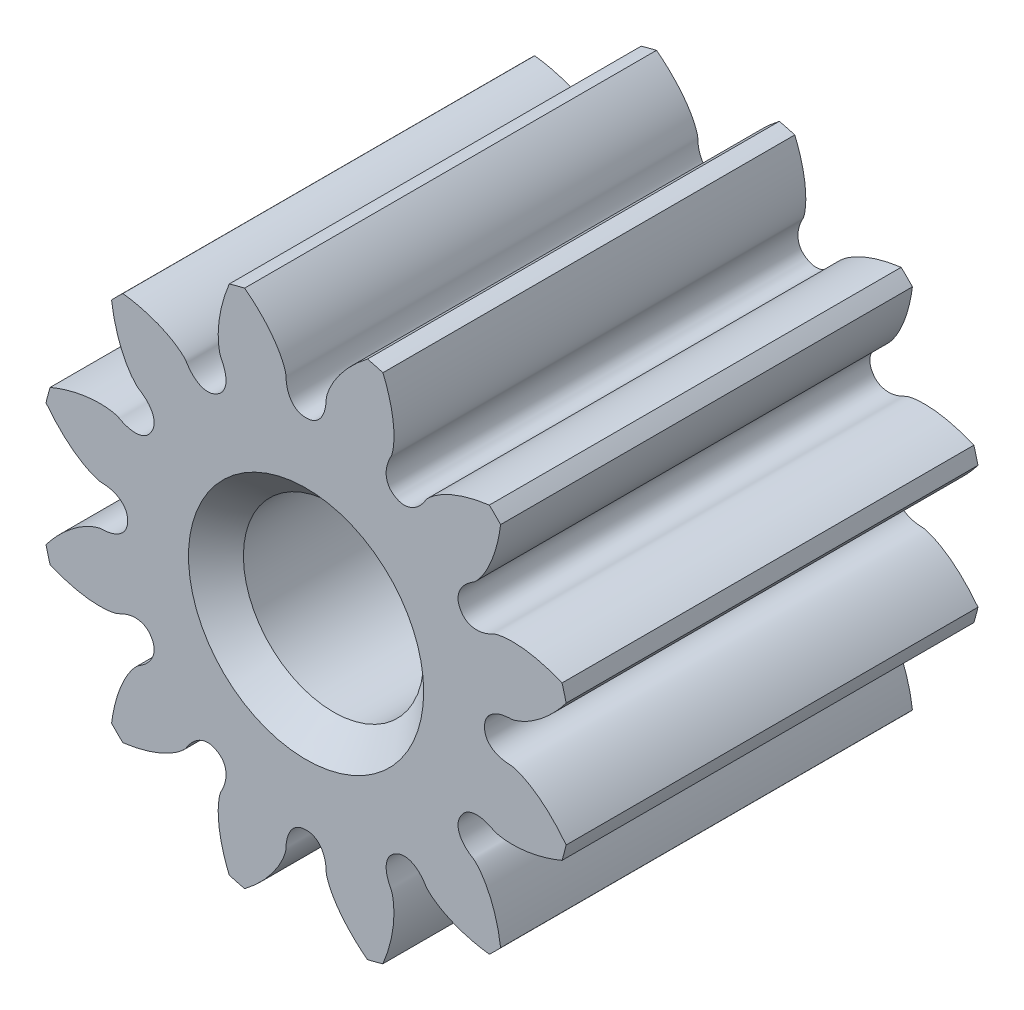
SolidWorks part; units mm, degrees
ref_plane "Front Plane" through (0, 0, 0) normal (0, 0, 1) x (1, 0, 0)
ref_plane "Top Plane" through (0, 0, 0) normal (0, 1, 0) x (1, 0, 0)
ref_plane "Right Plane" through (0, 0, 0) normal (1, 0, 0) x (0, 0, -1)
ref_plane "Plane1" through (0, 0, 2.25) normal (0, 0, 1) x (1, 0, 0)
sketch "Sketch1" plane through (0, 0, 2.25) normal (0, 0, 1) x (1, 0, 0)
  arc A0 (2.8418, 0.6712) -> (2.7967, 0.8396) centre (0, 0) ccw
  arc A1 (2.1254, 2.0022) -> (2.0022, 2.1254) centre (0, 0) ccw
  arc A2 (0.8396, 2.7967) -> (0.6712, 2.8418) centre (0, 0) ccw
  arc A3 (-0.6712, 2.8418) -> (-0.8396, 2.7967) centre (0, 0) ccw
  arc A4 (-2.0022, 2.1254) -> (-2.1254, 2.0022) centre (0, 0) ccw
  arc A5 (-2.7967, 0.8396) -> (-2.8418, 0.6712) centre (0, 0) ccw
  arc A6 (-2.8418, -0.6712) -> (-2.7967, -0.8396) centre (0, 0) ccw
  arc A7 (-2.1254, -2.0022) -> (-2.0022, -2.1254) centre (0, 0) ccw
  arc A8 (-0.8396, -2.7967) -> (-0.6712, -2.8418) centre (0, 0) ccw
  arc A9 (0.6712, -2.8418) -> (0.8396, -2.7967) centre (0, 0) ccw
  arc A10 (2.0022, -2.1254) -> (2.1254, -2.0022) centre (0, 0) ccw
  arc A11 (2.7967, -0.8396) -> (2.8418, -0.6712) centre (0, 0) ccw
  spline S0 degree 3 number of poles 191 (2.8418, 0.6712) -> (2.8418, -0.6712)
  spline S1 degree 3 number of poles 191 (2.1254, 2.0022) -> (2.7967, 0.8396)
  spline S2 degree 3 number of poles 191 (0.8396, 2.7967) -> (2.0022, 2.1254)
  spline S3 degree 3 number of poles 191 (-0.6712, 2.8418) -> (0.6712, 2.8418)
  spline S4 degree 3 number of poles 191 (-2.0022, 2.1254) -> (-0.8396, 2.7967)
  spline S5 degree 3 number of poles 191 (-2.7967, 0.8396) -> (-2.1254, 2.0022)
  spline S6 degree 3 number of poles 191 (-2.8418, -0.6712) -> (-2.8418, 0.6712)
  spline S7 degree 3 number of poles 191 (-2.1254, -2.0022) -> (-2.7967, -0.8396)
  spline S8 degree 3 number of poles 191 (-0.8396, -2.7967) -> (-2.0022, -2.1254)
  spline S9 degree 3 number of poles 191 (0.6712, -2.8418) -> (-0.6712, -2.8418)
  spline S10 degree 3 number of poles 191 (2.0022, -2.1254) -> (0.8396, -2.7967)
  spline S11 degree 3 number of poles 191 (2.7967, -0.8396) -> (2.1254, -2.0022)
extrude "Boss-Extrude1" add sketch "Sketch1" against normal blind 4.5
hole_wizard "#1 Clearance Hole1" positions "Sketch3" profile "Sketch2" hole size "#1" standard "ANSI Inch"
sketch "Sketch3" plane through (0, 0, 2.25) normal (0, 0, 1) x (1, 0, 0)
  point P0 (0, 0)
sketch "Sketch2" plane through (0, 0, 2.25) normal (1, 0, 0) x (0, -1, 0)
  line L0 (0, 0) -> (0, 4.5)
  line L1 (0, 4.5) -> (0.985, 4.5)
  line L2 (0.985, 4.5) -> (0.985, 0)
  line L5 (0.985, 0) -> (0, 0)
  line L11 (0, -6.35) -> (0, 107.95) construction
  dimension "Thru Hole Dia." = 1.97
  dimension "Thru Hole Depth" = 4.5
chamfer "Chamfer1" distance 0.3 angle 45 1 edges at (0.985, 0, 2.25)
